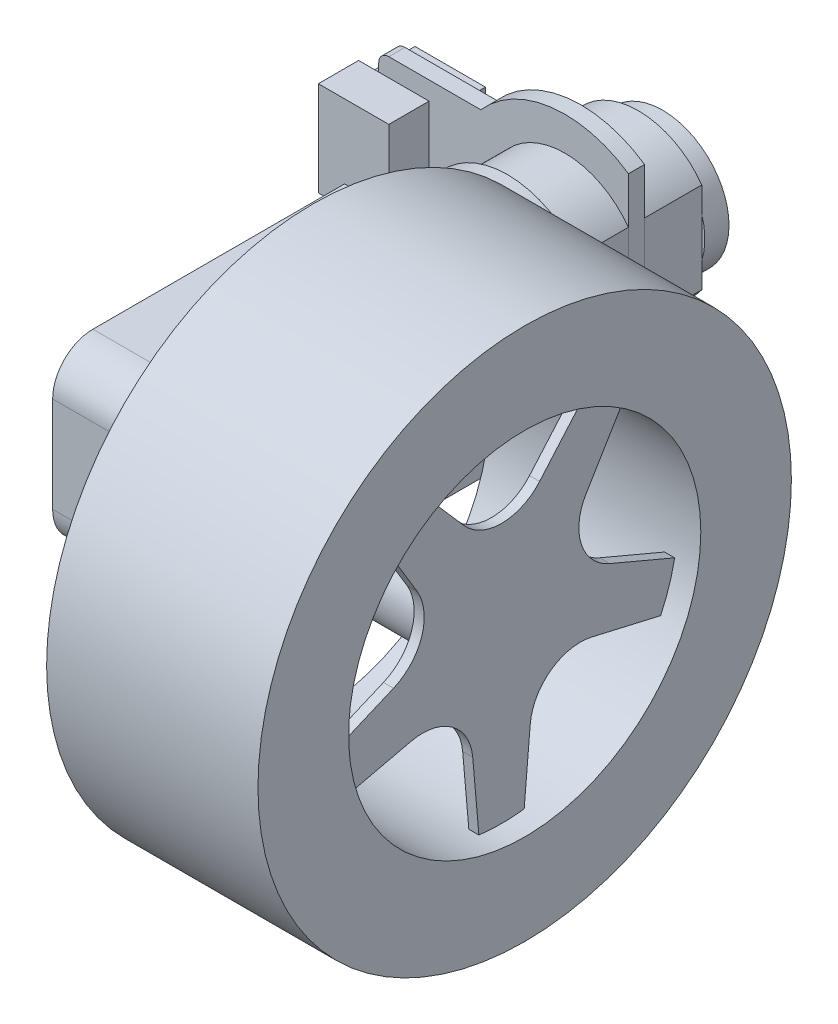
SolidWorks part; units mm, degrees
ref_plane "Front Plane" through (0, 0, 0) normal (0, 0, 1) x (1, 0, 0)
ref_plane "Top Plane" through (0, 0, 0) normal (0, 1, 0) x (1, 0, 0)
ref_plane "Right Plane" through (0, 0, 0) normal (1, 0, 0) x (0, 0, -1)
sketch "Sketch2" plane through (0, 0, 0) normal (1, 0, 0) x (0, 0, -1)
  circle A0 centre (0, 0) radius 33.655
  circle A1 centre (0, 0) radius 22.225
  dimension "D1" = 67.31
  dimension "D2" = 44.45
extrude "Boss-Extrude1" add sketch "Sketch2" along normal blind 26.67
sketch3d "3DSketch2" plane through (0, 0, 0) normal (0, 0, 1) x (1, 0, 0)
  dimension "D1" = 2.921
sketch "Sketch3" plane through (23.749, 0, 0) normal (1, 0, 0) x (0, 0, -1)
  line L0 (0, -29.7762) -> (2.8575, -22.0405)
  line L1 (0, -29.7762) -> (-2.8575, -22.0405)
  line L2 (-2.8575, -22.0405) -> (-3.6334, -13.1478)
  line L3 (2.8575, -22.0405) -> (3.6252, -13.1586)
  line L5 (-28.3189, -9.2014) -> (-20.0788, -9.5285)
  line L6 (-28.3189, -9.2014) -> (-21.8448, -4.0933)
  line L7 (-21.8448, -4.0933) -> (-13.6271, -0.6073)
  line L8 (-20.0788, -9.5285) -> (-11.3943, -7.514)
  line L10 (-17.502, 24.0895) -> (-15.2669, 16.1516)
  line L11 (-17.502, 24.0895) -> (-10.6433, 19.5108)
  line L12 (-10.6433, 19.5108) -> (-4.7886, 12.7724)
  line L13 (-15.2669, 16.1516) -> (-10.6673, 8.5147)
  line L15 (17.502, 24.0895) -> (10.6433, 19.5108)
  line L16 (17.502, 24.0895) -> (15.2669, 16.1516)
  line L17 (15.2669, 16.1516) -> (10.6676, 8.5011)
  line L18 (10.6433, 19.5108) -> (4.8016, 12.7763)
  line L20 (28.3189, -9.2014) -> (21.8448, -4.0933)
  line L21 (28.3189, -9.2014) -> (20.0788, -9.5285)
  line L22 (20.0788, -9.5285) -> (11.3815, -7.5185)
  line L23 (21.8448, -4.0933) -> (13.6348, -0.6185)
  arc A0 (3.6252, -13.1586) -> (11.3815, -7.5185) centre (9.9516, -13.7054) cw
  circle A1 centre (0, 0) radius 22.225 construction
  arc A2 (13.6348, -0.6185) -> (10.6676, 8.5011) centre (16.1098, 5.2293) cw
  arc A3 (4.8016, 12.7763) -> (-4.7886, 12.7724) centre (0.0048, 16.9373) cw
  arc A4 (-10.6673, 8.5147) -> (-13.6271, -0.6073) centre (-16.1068, 5.2385) cw
  arc A5 (-11.3943, -7.514) -> (-3.6334, -13.1478) centre (-9.9594, -13.6997) cw
  dimension "D1" = 5
  dimension "D2" = 6.35
extrude "Boss-Extrude2" add sketch "Sketch3" against normal blind 1.27
sketch "Sketch4" plane through (22.479, 0, 0) normal (-1, 0, 0) x (0, 0, 1)
  circle A0 centre (0, 0) radius 5.715
  dimension "D1" = 11.43
extrude "Boss-Extrude3" add sketch "Sketch4" along normal blind 26.67
sketch "Sketch5" plane through (-4.191, 0, 0) normal (-1, 0, 0) x (0, 0, 1)
  line L1 (5.08, 11.1125) -> (-26.67, 11.1125)
  line L2 (10.16, 6.0325) -> (10.16, -6.0325)
  line L3 (5.08, -11.1125) -> (-26.67, -11.1125)
  line L4 (-26.67, 11.1125) -> (-26.67, -11.1125)
  arc A0 (10.16, -6.0325) -> (5.08, -11.1125) centre (5.08, -6.0325) cw
  arc A1 (5.08, 11.1125) -> (10.16, 6.0325) centre (5.08, 6.0325) cw
  circle A2 centre (-21.971, -8.8265) radius 1.397
  circle A3 centre (-21.971, 8.8265) radius 1.397
  point P6 (10.16, -11.1125)
  point P9 (10.16, 11.1125)
  dimension "D3" = 5.08
  dimension "D6" = 2.794
  dimension "D7" = 2.794
  dimension "D1" = 22.225
  dimension "D2" = 36.83
  dimension "D4" = 11.1125
  dimension "D5" = 10.16
  dimension "D8" = 4.699
  dimension "D9" = 4.699
  dimension "D10" = 2.286
  dimension "D11" = 2.286
extrude "Boss-Extrude4" add sketch "Sketch5" along normal blind 18.542
sketch "Sketch6" plane through (0, 0, -26.67) normal (0, 0, -1) x (-1, 0, 0)
  line L0 (22.733, 11.1125) -> (22.733, -11.1125) construction
  line L1 (22.733, 6.1267) -> (22.733, -6.1267)
  line L2 (4.191, -6.1267) -> (4.191, 6.1267)
  line L3 (4.191, 11.1125) -> (4.191, -11.1125) construction
  arc A0 (22.733, 6.1267) -> (4.191, 6.1267) centre (13.462, 0) ccw
  arc A1 (4.191, -6.1267) -> (22.733, -6.1267) centre (13.462, 0) ccw
  dimension "D1" = 22.225
  dimension "D2" = 9.271
extrude "Boss-Extrude5" add sketch "Sketch6" along normal blind 11.303
sketch "Sketch8" plane through (0, 0, -37.973) normal (0, 0, -1) x (-1, 0, 0)
  line L4 (21.463, -5.7323) -> (21.463, 5.7323)
  line L5 (5.461, 5.7323) -> (5.461, -5.7323)
  arc A4 (5.461, -5.7323) -> (21.463, -5.7323) centre (13.462, 0) ccw
  arc A5 (21.463, 5.7323) -> (5.461, 5.7323) centre (13.462, 0) ccw
extrude "Boss-Extrude6" add sketch "Sketch8" along normal blind 16.51
sketch "Sketch9" plane through (0, 0, -54.483) normal (0, 0, -1) x (-1, 0, 0)
  circle A0 centre (13.462, 0) radius 8.382
  dimension "D1" = 16.764
extrude "Boss-Extrude7" add sketch "Sketch9" along normal blind 3.048
sketch3d "3DSketch3" plane through (0, 0, 0) normal (0, 0, 1) x (1, 0, 0)
  dimension "D1" = 7.239
sketch "Sketch10" plane through (0, 0, -47.244) normal (0, 0, -1) x (-1, 0, 0)
  line L0 (5.4469, -11.5967) -> (5.4469, 11.5967)
  line L2 (5.461, 5.7323) -> (5.461, -5.7323) construction
  line L4 (24.0815, -9.271) -> (35.687, -9.271)
  line L6 (24.0815, 9.271) -> (35.687, 9.271)
  line L7 (36.957, -8.001) -> (36.957, 8.001)
  arc A0 (5.4469, -11.5967) -> (24.0815, -9.271) centre (13.462, 0) ccw
  arc A1 (24.0815, 9.271) -> (5.4469, 11.5967) centre (13.462, 0) ccw
  arc A2 (35.687, 9.271) -> (36.957, 8.001) centre (35.687, 8.001) cw
  arc A3 (35.687, -9.271) -> (36.957, -8.001) centre (35.687, -8.001) ccw
  point P11 (36.957, 9.271)
  point P15 (36.957, -9.271)
  dimension "D1" = 28.194
  dimension "D5" = 1.27
  dimension "D2" = 18.542
  dimension "D3" = 9.271
  dimension "D4" = 23.495
extrude "Boss-Extrude8" add sketch "Sketch10" against normal blind 2.032
sketch "Sketch11" plane through (0, 0, -45.212) normal (0, 0, 1) x (1, 0, 0)
  line L0 (-36.957, -8.001) -> (-36.957, 8.001) construction
  line L1 (-30.607, -4.9865) -> (-39.497, -4.9865)
  line L2 (-30.607, -4.9865) -> (-30.607, 6.9515)
  line L3 (-30.607, 6.9515) -> (-39.497, 6.9515)
  line L4 (-39.497, -4.9865) -> (-39.497, 6.9515)
  dimension "D1" = 11.938
  dimension "D2" = 8.89
  dimension "D3" = 6.35
extrude "Boss-Extrude9" add sketch "Sketch11" along normal blind 5.08
sketch "Sketch12" plane through (0, 0, -47.244) normal (0, 0, -1) x (-1, 0, 0)
  line L0 (36.957, -8.001) -> (36.957, 8.001) construction
  line L1 (39.497, -2.9448) -> (30.607, -2.9448)
  line L2 (39.497, -2.9448) -> (39.497, 4.9292)
  line L3 (39.497, 4.9292) -> (30.607, 4.9292)
  line L4 (30.607, -2.9448) -> (30.607, 4.9292)
  dimension "D1" = 7.874
  dimension "D2" = 6.35
  dimension "D3" = 8.89
extrude "Boss-Extrude10" add sketch "Sketch12" along normal blind 5.08
